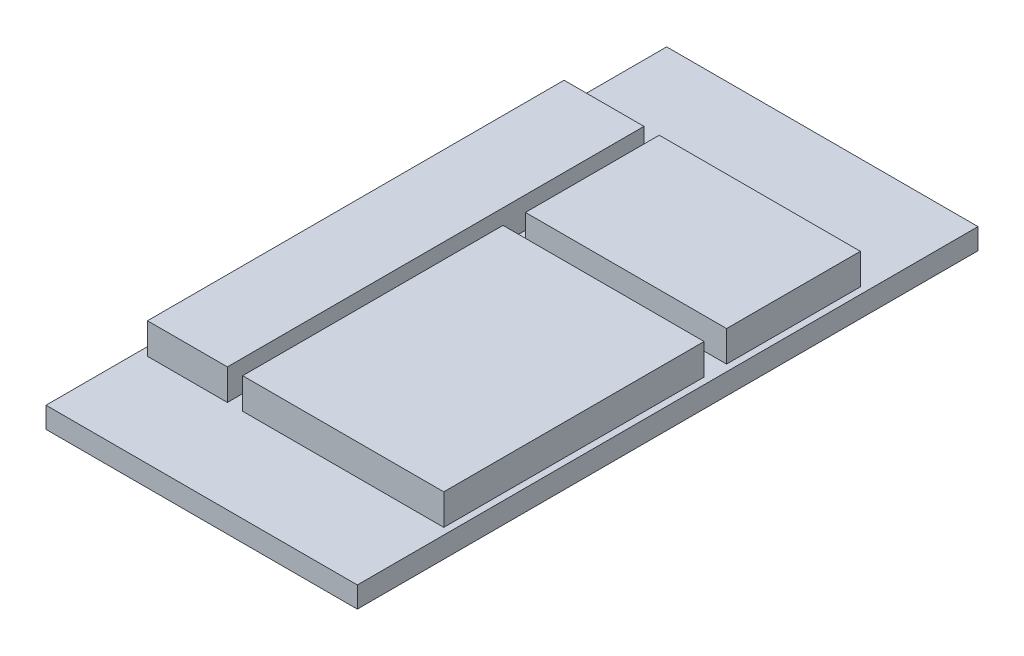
SolidWorks part; units mm, degrees
ref_plane "Front Plane" through (0, 0, 0) normal (0, 0, 1) x (1, 0, 0)
ref_plane "Top Plane" through (0, 0, 0) normal (0, 1, 0) x (1, 0, 0)
ref_plane "Right Plane" through (0, 0, 0) normal (1, 0, 0) x (0, 0, -1)
sketch "Sketch1" plane through (0, 0, 0) normal (0, 1, 0) x (1, 0, 0)
  line L1 (0, 0) -> (23.75, 0)
  line L2 (0, 0) -> (0, 47.35)
  line L3 (0, 47.35) -> (23.75, 47.35)
  line L4 (23.75, 0) -> (23.75, 47.35)
  dimension "D1" = 23.75
  dimension "D2" = 47.35
extrude "Boss-Extrude1" add sketch "Sketch1" along normal blind 1.6
sketch "Sketch2" plane through (0, 1.6, 0) normal (0, 1, 0) x (1, 0, 0)
  line L1 (23.2446, 7.1) -> (7.9025, 7.1)
  line L2 (23.2446, 7.1) -> (23.2446, 26.9626)
  line L3 (23.2446, 26.9626) -> (7.9025, 26.9626)
  line L4 (7.9025, 7.1) -> (7.9025, 26.9626)
  line L5 (0.6423, 7.1) -> (6.7381, 7.1)
  line L6 (0.6423, 7.1) -> (0.6423, 38.8802)
  line L7 (0.6423, 38.8802) -> (6.7381, 38.8802)
  line L8 (6.7381, 7.1) -> (6.7381, 38.8802)
  line L9 (7.9025, 38.8802) -> (23.2446, 38.8802)
  line L10 (7.9025, 38.8802) -> (7.9025, 28.6749)
  line L11 (7.9025, 28.6749) -> (23.2446, 28.6749)
  line L12 (23.2446, 38.8802) -> (23.2446, 28.6749)
extrude "Boss-Extrude2" add sketch "Sketch2" along normal blind 2.35
